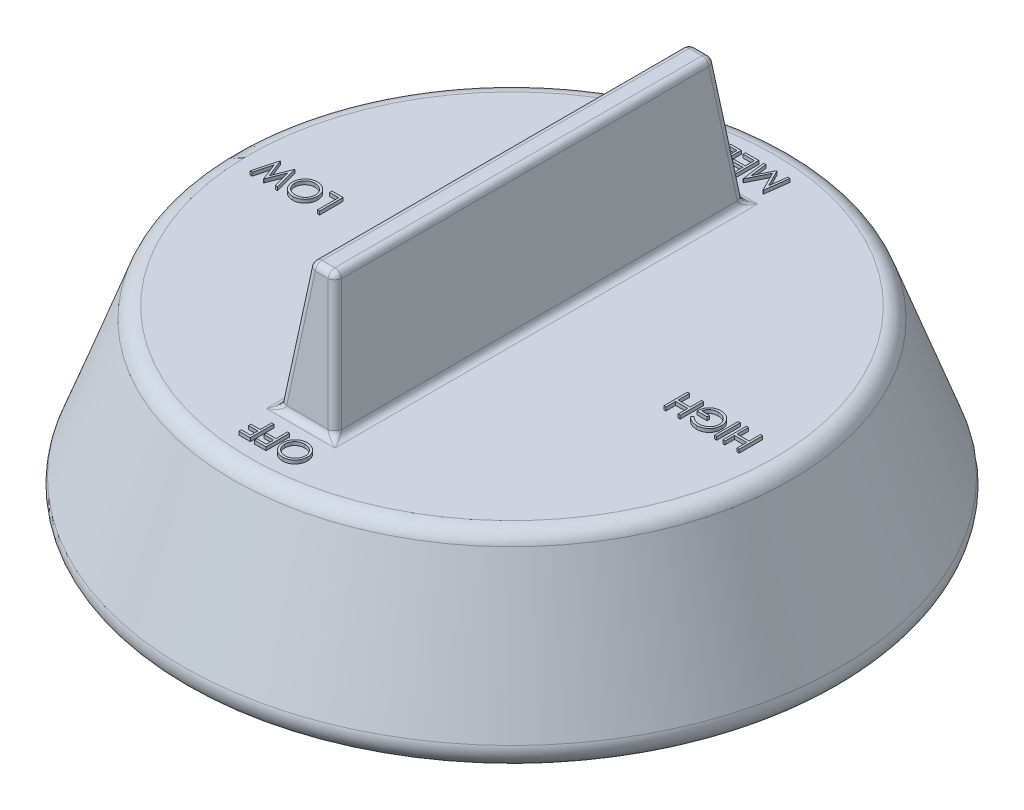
SolidWorks part; units mm, degrees
ref_plane "Front Plane" through (0, 0, 0) normal (0, 0, 1) x (1, 0, 0)
ref_plane "Top Plane" through (0, 0, 0) normal (0, 1, 0) x (1, 0, 0)
ref_plane "Right Plane" through (0, 0, 0) normal (1, 0, 0) x (0, 0, -1)
sketch "Sketch1" plane through (0, 0, 0) normal (0, 0, 1) x (1, 0, 0)
  line L0 (0, 0) -> (0, -26.5499) construction
  line L1 (29.6232, -25.4) -> (50, -25.4)
  line L2 (50, -25.4) -> (40.7552, 0)
  line L3 (40.7552, 0) -> (0, 0)
  line L4 (0, 0) -> (0, -25.4)
  line L5 (0, -25.4) -> (29.6232, -25.4)
  dimension "D1" = 25.4
  dimension "D2" = 50
  dimension "D3" = 70
revolve "Revolve1" add sketch "Sketch1" angle 360 about L0
shell "Shell1" thickness 6.35
fillet "Fillet1" radius 2.54 2 edges at (0, -25.4, 50) (0, 0, 40.7552)
sketch "Sketch2" plane through (0, 0, 0) normal (0, 1, 0) x (1, 0, 0)
  line L0 (0, 0) -> (0, 33.5799) construction
  line L1 (0, 0) -> (0, -32.7298) construction
  line L2 (0, 30.48) -> (4.191, 30.48)
  line L3 (4.191, 30.48) -> (4.191, -30.48)
  line L4 (4.191, -30.48) -> (0, -30.48)
  line L5 (0, -30.48) -> (-4.191, -30.48)
  line L6 (-4.191, -30.48) -> (-4.191, 30.48)
  line L7 (-4.191, 30.48) -> (0, 30.48)
  dimension "D1" = 4.191
  dimension "D2" = 4.191
  dimension "D3" = 30.48
  dimension "D4" = 30.48
extrude "Extrude1" add sketch "Sketch2" along normal blind 19.05 draft 7
fillet "Fillet3" radius 1.016 4 edges at (1.852, 19.05, 0) (0, 19.05, 28.141) (-1.852, 19.05, 0) (0, 19.05, -28.141)
fillet "Fillet4" radius 1.016 4 edges at (-4.191, 0, 0) (0, 0, -30.48) (4.191, 0, 0) (0, 0, 30.48)
sketch "Sketch3" plane through (0, -6.35, 0) normal (0, -1, 0) x (1, 0, 0)
  line L0 (0, 0) -> (0, 25.4) construction
  line L1 (0, 25.4) -> (0, 0) construction
  line L2 (0, 0) -> (0, -22.164) construction
  line L3 (-1.9615, 28.2505) -> (-1.9615, -28.2505) construction
  line L4 (-1.9615, 24.5929) -> (1.9615, 24.5929)
  line L5 (-1.9615, 24.5929) -> (-1.9615, -25.4)
  line L6 (-1.9615, -25.4) -> (1.9615, -25.4)
  line L7 (1.9615, 24.5929) -> (1.9615, -25.4)
  line L8 (1.9615, -28.2505) -> (1.9615, 28.2505) construction
  line L9 (0.9531, 27.2421) -> (0.9531, -27.2421) construction
  point P12 (0.9531, 0)
  dimension "D1" = 25.4
  dimension "D2" = 25.4
extrude "Cut-Extrude1" cut sketch "Sketch3" against normal blind 15.24 draft 2
fillet "Fillet6" radius 0.254 1 edges at (0, -6.35, -36.3088)
fillet "Fillet7" radius 1.016 12 edges at (-1.6263, 18.7949, -27.9153) (-4.4167, 0.2551, -30.7057) (1.6263, 18.7949, -27.9153) (4.4167, 0.2551, -30.7057) (-1.6263, 18.7949, 27.9153) (-4.4167, 0.2551, 30.7057) (1.6263, 18.7949, 27.9153) (4.4167, 0.2551, 30.7057) (-3.0215, 9.525, -29.3105) (3.0215, 9.525, -29.3105) (-3.0215, 9.525, 29.3105) (3.0215, 9.525, 29.3105)
sketch "Sketch4" plane through (0, -6.35, 0) normal (0, -1, 0) x (1, 0, 0)
  line L0 (0, 0) -> (0, 18.2777)
  line L1 (0, 0) -> (0, -15.4844)
  circle A0 centre (0, 0) radius 11.2615
  circle A1 centre (0, 0) radius 8.6598
extrude "Extrude2" add sketch "Sketch4" along normal blind 15.24 contours A0 | A1
sketch "Sketch5" plane through (0, -21.59, 0) normal (0, -1, 0) x (1, 0, 0)
  line L0 (0, 0) -> (0, 27.2421) construction
  line L1 (-1.905, -31.1864) -> (1.905, -31.1864)
  line L2 (-1.905, 19.6136) -> (1.905, 19.6136)
  line L3 (1.905, -31.1864) -> (1.905, 19.6136)
  line L4 (-0.9531, 27.2421) -> (0.9531, 27.2421) construction
  line L5 (0, 0) -> (0, -28.2505) construction
  line L6 (-1.905, 19.6136) -> (-1.905, -31.1864)
  line L7 (-0.9531, -28.2505) -> (0.9531, -28.2505) construction
  dimension "D1" = 1.905
  dimension "D2" = 1.905
  dimension "D3" = 50.8
extrude "Cut-Extrude5" cut sketch "Sketch5" against normal blind 15.24
fillet "Fillet10" radius 0.254 2 edges at (-1.9615, -6.35, 0) (1.9615, -6.35, 0)
fillet "Fillet11" radius 0.254 2 edges at (-11.2615, -6.35, 0) (11.2615, -6.35, 0)
fillet "Fillet12" radius 0.254 10 edges at (-1.9649, -6.4467, -11.1441) (-1.9635, -6.4073, 11.1837) (1.9649, -6.4467, 11.1441) (1.9635, -6.4073, -11.1837) (-1.9615, -6.35, -18.3736) (0, -6.35, -25.4) (1.9615, -6.35, -18.3736) (-1.9615, -6.35, 17.97) (0, -6.35, 24.5929) (1.9615, -6.35, 17.97)
fillet "Fillet13" radius 0.254 6 edges at (-2.0444, -6.2913, 8.415) (-2.0116, -6.2585, -8.4229) (2.0444, -6.2913, -8.415) (2.0116, -6.2585, 8.4229) (-8.6598, -6.35, 0) (8.6598, -6.35, 0)
sketch "Sketch11" plane through (0, 0, 0) normal (0, 1, 0) x (-1, 0, 0)
  text T0 "OFF  "
extrude "Extrude3" add sketch "Sketch11" along normal blind 0.508
sketch "Sketch17" plane through (0, 0, 0) normal (0, 1, 0) x (-1, 0, 0)
  text T0 "LOW"
extrude "Extrude4" add sketch "Sketch17" along normal blind 0.508
sketch "Sketch20" plane through (0, 0, 0) normal (0, 1, 0) x (-1, 0, 0)
  text T0 "MED"
extrude "Extrude5" add sketch "Sketch20" along normal blind 0.508
sketch "Sketch24" plane through (0, 0, 0) normal (0, 1, 0) x (-1, 0, 0)
  text T0 "HIGH"
extrude "Extrude6" add sketch "Sketch24" along normal blind 0.508
